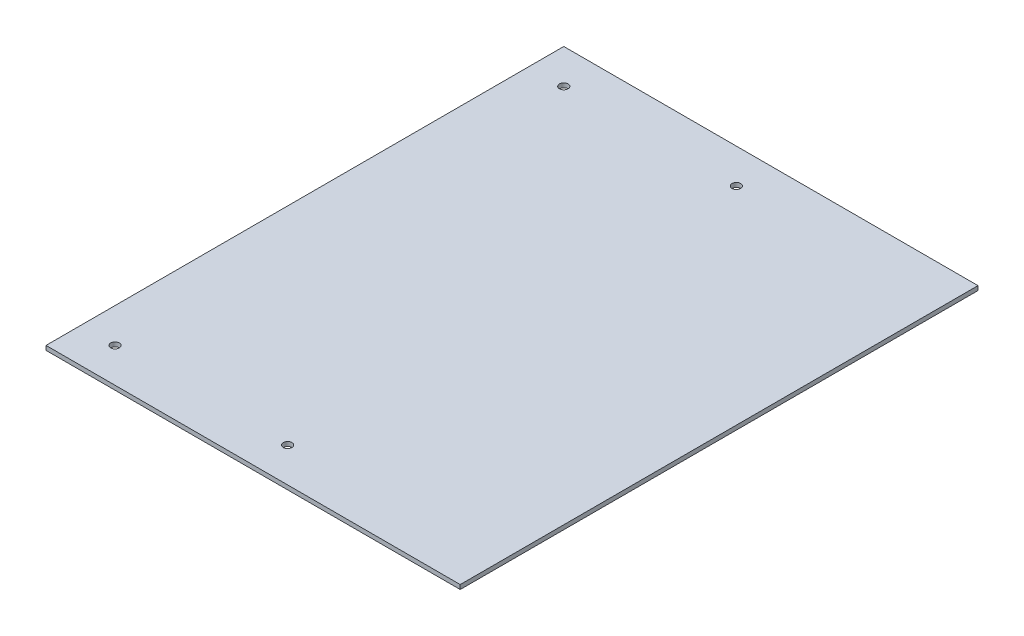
SolidWorks part; units mm, degrees
ref_plane "Front" through (0, 0, 0) normal (0, 0, 1) x (1, 0, 0)
ref_plane "Top" through (0, 0, 0) normal (0, 1, 0) x (1, 0, 0)
ref_plane "Right" through (0, 0, 0) normal (1, 0, 0) x (0, 0, -1)
sketch "스케치1" plane through (0, 0, 0) normal (0, 1, 0) x (1, 0, 0)
  line L1 (76.2, -95.25) -> (-76.2, -95.25)
  line L2 (76.2, -95.25) -> (76.2, 95.25)
  line L3 (76.2, 95.25) -> (-76.2, 95.25)
  line L4 (-76.2, -95.25) -> (-76.2, 95.25)
  line L5 (0, 95.25) -> (0, -95.25) construction
  line L6 (76.2, 0) -> (-76.2, 0) construction
  circle A0 centre (-63.5, -82.55) radius 1.5875
  circle A1 centre (0, -82.55) radius 1.5875
  circle A4 centre (0, 82.55) radius 1.5875
  circle A5 centre (-63.5, 82.55) radius 1.5875
  point P0 (0, 0)
  dimension "D9" = 3.175
  dimension "D10" = 3.175
  dimension "D1" = 152.4
  dimension "D2" = 190.5
  dimension "D5" = 12.7
  dimension "D6" = 12.7
  dimension "D7" = 12.7
extrude "보스-돌출1" add sketch "스케치1" along normal blind 1.5875
